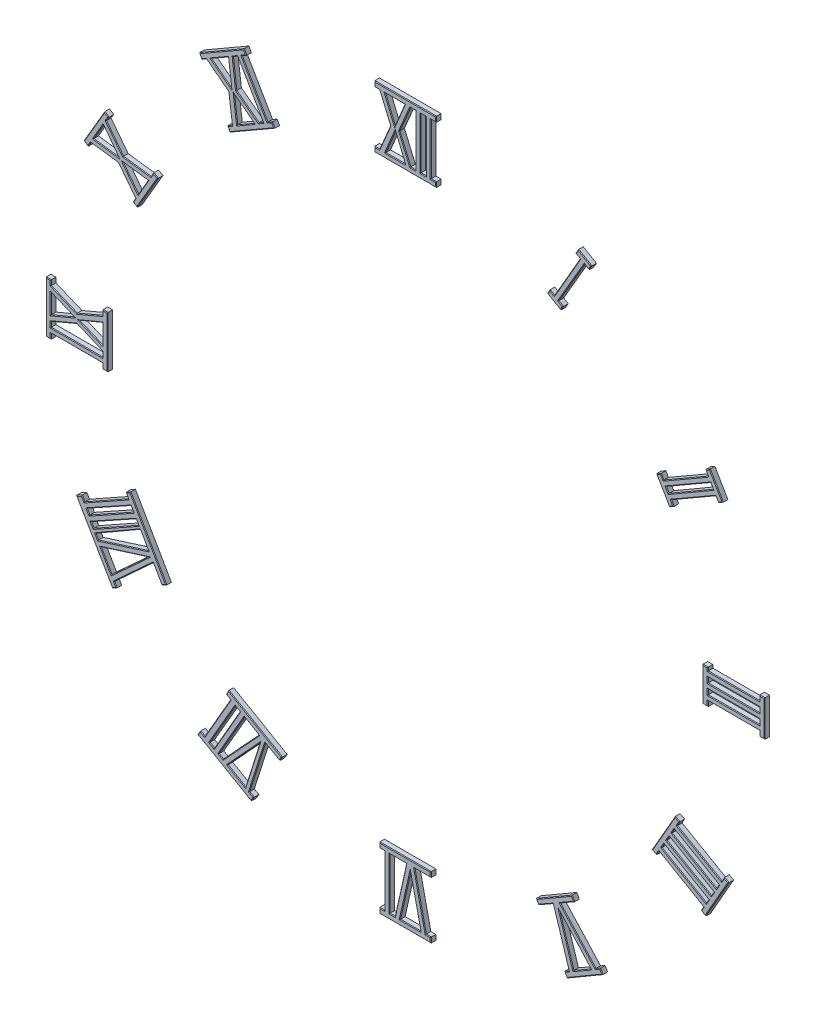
SolidWorks part; units mm, degrees
ref_plane "Спереди" through (0, 0, 0) normal (0, 0, 1) x (1, 0, 0)
ref_plane "Сверху" through (0, 0, 0) normal (0, 1, 0) x (1, 0, 0)
ref_plane "Справа" through (0, 0, 0) normal (1, 0, 0) x (0, 0, -1)
sketch "Эскиз1" plane through (0, 0, 0) normal (0, 0, 1) x (1, 0, 0)
  line L0 (-0.0444, 118.9128) -> (-0.0444, 118.6476)
  line L1 (-3.7575, 127.7538) -> (-0.0444, 118.9128)
  line L2 (-3.7575, 127.7538) -> (-7.5591, 118.6476)
  line L3 (-7.5591, 118.6476) -> (-0.0444, 118.6476)
  line L4 (-3.9345, 129.5221) -> (-7.736, 138.6283)
  line L5 (-3.9345, 129.5221) -> (-0.1327, 138.6283)
  line L6 (-7.736, 138.6283) -> (-0.1327, 138.6283)
  line L7 (-2.1661, 128.6381) -> (2.0775, 138.6283)
  line L8 (-2.1661, 128.6381) -> (2.0775, 118.6476)
  line L9 (2.0775, 118.6476) -> (4.1111, 118.6476)
  line L10 (4.1111, 138.6283) -> (4.1111, 118.6476)
  line L11 (2.0775, 138.6283) -> (4.1111, 138.6283)
  line L12 (6.056, 138.6283) -> (6.056, 118.6476)
  line L13 (6.056, 118.6476) -> (8.0896, 118.6476)
  line L14 (8.0896, 138.6283) -> (8.0896, 118.6476)
  line L15 (6.056, 138.6283) -> (8.0896, 138.6283)
  line L16 (-11.8915, 140.6619) -> (12.0681, 140.6619)
  line L17 (12.0681, 140.6619) -> (12.0681, 138.6283)
  line L18 (10.0345, 138.6283) -> (12.0681, 138.6283)
  line L19 (10.0345, 138.6283) -> (10.0345, 118.6476)
  line L20 (10.0345, 118.6476) -> (12.0681, 118.6476)
  line L21 (12.0681, 116.7026) -> (12.0681, 118.6476)
  line L22 (-11.8915, 116.7026) -> (12.0681, 116.7026)
  line L23 (-11.8915, 116.7026) -> (-11.8915, 118.6476)
  line L24 (-11.8915, 118.6476) -> (-9.9462, 118.6476)
  line L25 (-9.9462, 118.6476) -> (-5.7026, 128.6381)
  line L26 (-9.9462, 138.6283) -> (-5.7026, 128.6381)
  line L27 (-11.8915, 138.6283) -> (-9.9462, 138.6283)
  line L28 (-11.8915, 140.6619) -> (-11.8915, 138.6283)
  line L29 (69.712, 119.7968) -> (71.3917, 118.7358)
  line L30 (69.712, 119.7968) -> (59.633, 102.4683)
  line L31 (59.633, 102.4683) -> (61.4015, 101.4074)
  line L32 (60.4287, 99.7276) -> (61.4015, 101.4074)
  line L33 (55.2126, 102.7336) -> (60.4287, 99.7276)
  line L34 (55.2126, 102.7336) -> (56.1851, 104.4133)
  line L35 (56.1851, 104.4133) -> (57.9534, 103.4408)
  line L36 (67.9438, 120.7694) -> (57.9534, 103.4408)
  line L37 (66.1757, 121.7419) -> (67.9438, 120.7694)
  line L38 (67.2366, 123.51) -> (66.1757, 121.7419)
  line L39 (67.2366, 123.51) -> (72.3642, 120.5042)
  line L40 (72.3642, 120.5042) -> (71.3917, 118.7358)
  line L41 (118.6032, 70.8172) -> (119.5759, 69.0491)
  line L42 (118.6032, 70.8172) -> (101.2748, 60.8267)
  line L43 (101.2748, 60.8267) -> (102.3357, 59.0584)
  line L44 (119.5759, 69.0491) -> (102.3357, 59.0584)
  line L45 (118.3379, 75.2377) -> (123.3774, 66.5735)
  line L46 (123.3774, 66.5735) -> (121.6094, 65.6009)
  line L47 (120.6367, 67.3692) -> (121.6094, 65.6009)
  line L48 (120.6367, 67.3692) -> (103.3083, 57.3787)
  line L49 (103.3083, 57.3787) -> (104.2806, 55.6104)
  line L50 (102.6008, 54.638) -> (104.2806, 55.6104)
  line L51 (97.5615, 63.3022) -> (102.6008, 54.638)
  line L52 (97.5615, 63.3022) -> (99.3298, 64.2749)
  line L53 (99.3298, 64.2749) -> (100.3021, 62.5065)
  line L54 (117.6309, 72.497) -> (100.3021, 62.5065)
  line L55 (116.6582, 74.2652) -> (117.6309, 72.497)
  line L56 (118.3379, 75.2377) -> (116.6582, 74.2652)
  line L57 (117.5422, 4.9508) -> (117.5422, 2.9175)
  line L58 (117.5422, 2.9175) -> (137.5233, 2.9175)
  line L59 (137.5233, 4.9508) -> (137.5233, 2.9175)
  line L60 (117.5422, 4.9508) -> (137.5233, 4.9508)
  line L61 (117.5422, 0.9723) -> (117.5422, -1.0612)
  line L62 (117.5422, -1.0612) -> (137.5233, -1.0612)
  line L63 (137.5233, 0.9723) -> (137.5233, -1.0612)
  line L64 (117.5422, 0.9723) -> (137.5233, 0.9723)
  line L65 (137.5233, -3.0062) -> (137.5233, -5.0395)
  line L66 (117.5422, -3.0062) -> (137.5233, -3.0062)
  line L67 (117.5422, -3.0062) -> (117.5422, -5.0395)
  line L68 (117.5422, -5.0395) -> (115.5089, -5.0395)
  line L69 (115.5089, 8.2222) -> (115.5089, -5.0395)
  line L70 (117.5422, 8.2222) -> (115.5089, 8.2222)
  line L71 (117.5422, 8.2222) -> (117.5422, 6.9845)
  line L72 (117.5422, 6.9845) -> (137.5233, 6.9845)
  line L73 (137.5233, 8.9293) -> (137.5233, 6.9845)
  line L74 (137.5233, 8.9293) -> (139.5566, 8.9293)
  line L75 (139.5566, 8.9293) -> (139.5566, -5.0395)
  line L76 (137.5233, -5.0395) -> (139.5566, -5.0395)
  line L77 (-120.9022, 66.662) -> (-117.1005, 73.2043)
  line L78 (-111.0886, 65.3357) -> (-120.9022, 66.662)
  line L79 (-111.0886, 65.3357) -> (-117.1005, 73.2043)
  line L80 (-105.6071, 53.0466) -> (-104.6345, 54.8147)
  line L81 (-104.6345, 54.8147) -> (-111.2653, 63.3907)
  line L82 (-121.9631, 64.8052) -> (-111.2653, 63.3907)
  line L83 (-123.0241, 63.0369) -> (-121.9631, 64.8052)
  line L84 (-124.7039, 64.0979) -> (-123.0241, 63.0369)
  line L85 (-124.7039, 64.0979) -> (-116.6585, 77.89)
  line L86 (-116.6585, 77.89) -> (-114.9786, 76.8291)
  line L87 (-116.0395, 75.1493) -> (-114.9786, 76.8291)
  line L88 (-109.4087, 66.485) -> (-116.0395, 75.1493)
  line L89 (-109.4087, 66.485) -> (-98.6226, 65.0706)
  line L90 (-98.6226, 65.0706) -> (-97.6501, 66.8387)
  line L91 (-97.6501, 66.8387) -> (-95.8818, 65.8663)
  line L92 (-103.9273, 52.074) -> (-95.8818, 65.8663)
  line L93 (-103.9273, 52.074) -> (-105.6071, 53.0466)
  line L94 (-103.5736, 56.6713) -> (-99.772, 63.2138)
  line L95 (-109.5856, 64.54) -> (-99.772, 63.2138)
  line L96 (-109.5856, 64.54) -> (-103.5736, 56.6713)
  line L97 (104.5458, -52.693) -> (121.8745, -62.6836)
  line L98 (104.5458, -52.693) -> (103.5734, -54.4613)
  line L99 (103.5734, -54.4613) -> (120.9019, -64.4516)
  line L100 (121.8745, -62.6836) -> (120.9019, -64.4516)
  line L101 (102.6008, -56.141) -> (119.9296, -66.1316)
  line L102 (102.6008, -56.141) -> (101.54, -57.9094)
  line L103 (101.54, -57.9094) -> (118.8684, -67.8997)
  line L104 (119.9296, -66.1316) -> (118.8684, -67.8997)
  line L105 (100.5673, -59.6774) -> (117.896, -69.6679)
  line L106 (100.5673, -59.6774) -> (99.5949, -61.3574)
  line L107 (99.5949, -61.3574) -> (116.9234, -71.3478)
  line L108 (117.896, -69.6679) -> (116.9234, -71.3478)
  line L109 (125.5879, -60.208) -> (116.6582, -75.8567)
  line L110 (114.8899, -74.7957) -> (116.6582, -75.8567)
  line L111 (115.8625, -73.116) -> (114.8899, -74.7957)
  line L112 (98.6223, -63.1255) -> (115.8625, -73.116)
  line L113 (98.6223, -63.1255) -> (97.5615, -64.8054)
  line L114 (97.5615, -64.8054) -> (95.8817, -63.8328)
  line L115 (104.811, -48.2725) -> (95.8817, -63.8328)
  line L116 (104.811, -48.2725) -> (106.5793, -49.245)
  line L117 (106.5793, -49.245) -> (105.6067, -51.0133)
  line L118 (105.6067, -51.0133) -> (122.9355, -61.0037)
  line L119 (123.9078, -59.2355) -> (122.9355, -61.0037)
  line L120 (125.5879, -60.208) -> (123.9078, -59.2355)
  line L121 (65.38, -119.797) -> (59.8984, -102.3801)
  line L122 (72.1874, -115.9069) -> (65.38, -119.797)
  line L123 (72.1874, -115.9069) -> (59.8984, -102.3801)
  line L124 (63.6115, -120.858) -> (61.8433, -121.8306)
  line L125 (63.6115, -120.858) -> (57.423, -101.3191)
  line L126 (57.423, -101.3191) -> (51.8531, -104.5019)
  line L127 (50.8804, -102.822) -> (51.8531, -104.5019)
  line L128 (64.761, -94.7768) -> (50.8804, -102.822)
  line L129 (64.761, -94.7768) -> (65.7335, -96.5449)
  line L130 (65.7335, -96.5449) -> (60.1636, -99.7277)
  line L131 (73.9556, -114.846) -> (60.1636, -99.7277)
  line L132 (75.724, -113.8736) -> (73.9556, -114.846)
  line L133 (75.724, -113.8736) -> (76.6965, -115.5532)
  line L134 (76.6965, -115.5532) -> (62.9043, -123.5987)
  line L135 (61.8433, -121.8306) -> (62.9043, -123.5987)
  line L136 (-7.913, -116.2607) -> (-9.9462, -116.2607)
  line L137 (-9.9462, -114.2271) -> (-9.9462, -116.2607)
  line L138 (10.0345, -114.2271) -> (-9.9462, -114.2271)
  line L139 (10.0345, -114.2271) -> (10.0345, -116.2607)
  line L140 (10.0345, -116.2607) -> (3.6689, -116.2607)
  line L141 (8.0896, -136.2414) -> (3.6689, -116.2607)
  line L142 (10.0345, -136.2414) -> (8.0896, -136.2414)
  line L143 (10.0345, -136.2414) -> (10.0345, -138.275)
  line L144 (-1.901, -136.2414) -> (2.0775, -118.4709)
  line L145 (6.056, -136.2414) -> (2.0775, -118.4709)
  line L146 (6.056, -136.2414) -> (-1.901, -136.2414)
  line L147 (-3.9345, -136.2414) -> (-5.9677, -136.2414)
  line L148 (-5.9677, -116.2607) -> (-5.9677, -136.2414)
  line L149 (0.4861, -116.2607) -> (-5.9677, -116.2607)
  line L150 (-3.9345, -136.2414) -> (0.4861, -116.2607)
  line L151 (10.0345, -138.275) -> (-9.9462, -138.275)
  line L152 (-9.9462, -136.2414) -> (-9.9462, -138.275)
  line L153 (-7.913, -136.2414) -> (-9.9462, -136.2414)
  line L154 (-7.913, -116.2607) -> (-7.913, -136.2414)
  line L155 (-70.5963, -116.7026) -> (-72.2761, -115.7301)
  line L156 (-70.5963, -116.7026) -> (-56.7158, -101.6728)
  line L157 (-56.7158, -101.6728) -> (-62.2857, -98.4016)
  line L158 (-62.2857, -98.4016) -> (-72.2761, -115.7301)
  line L159 (-61.932, -121.742) -> (-56.4505, -104.3252)
  line L160 (-68.828, -117.7635) -> (-56.4505, -104.3252)
  line L161 (-61.932, -121.742) -> (-68.828, -117.7635)
  line L162 (-64.0538, -97.429) -> (-65.8221, -96.4564)
  line L163 (-65.8221, -96.4564) -> (-75.8126, -113.6967)
  line L164 (-74.0445, -114.7575) -> (-75.8126, -113.6967)
  line L165 (-64.0538, -97.429) -> (-74.0445, -114.7575)
  line L166 (-47.6978, -104.5903) -> (-48.6703, -106.2701)
  line L167 (-48.6703, -106.2701) -> (-54.2402, -103.0873)
  line L168 (-60.429, -122.6263) -> (-54.2402, -103.0873)
  line L169 (-58.6608, -123.5987) -> (-60.429, -122.6263)
  line L170 (-59.7219, -125.3669) -> (-80.4983, -113.343)
  line L171 (-79.4374, -111.6632) -> (-80.4983, -113.343)
  line L172 (-77.7576, -112.6357) -> (-79.4374, -111.6632)
  line L173 (-67.7671, -95.3072) -> (-77.7576, -112.6357)
  line L174 (-67.7671, -95.3072) -> (-69.447, -94.3346)
  line L175 (-68.4746, -92.5664) -> (-69.447, -94.3346)
  line L176 (-47.6978, -104.5903) -> (-68.4746, -92.5664)
  line L177 (-58.6608, -123.5987) -> (-59.7219, -125.3669)
  line L178 (-99.5951, -61.1805) -> (-102.7779, -55.6106)
  line L179 (-102.7779, -55.6106) -> (-120.1065, -65.6011)
  line L180 (-119.134, -67.3693) -> (-120.1065, -65.6011)
  line L181 (-119.134, -67.3693) -> (-99.5951, -61.1805)
  line L182 (-94.3789, -70.1984) -> (-97.7384, -64.275)
  line L183 (-112.8567, -78.1553) -> (-97.7384, -64.275)
  line L184 (-111.8843, -79.8352) -> (-112.8567, -78.1553)
  line L185 (-125.4112, -55.4338) -> (-127.6215, -56.5832)
  line L186 (-92.6107, -69.2258) -> (-106.5796, -44.9129)
  line L187 (-92.6107, -69.2258) -> (-94.3789, -70.1984)
  line L188 (-122.4936, -60.65) -> (-123.4661, -58.8817)
  line L189 (-105.3419, -51.1016) -> (-122.4936, -60.65)
  line L190 (-105.3419, -51.1016) -> (-106.4028, -49.4219)
  line L191 (-118.0731, -69.1375) -> (-99.5951, -63.3023)
  line L192 (-113.9177, -76.3871) -> (-118.0731, -69.1375)
  line L193 (-113.9177, -76.3871) -> (-99.5951, -63.3023)
  line L194 (-104.3693, -52.8699) -> (-121.8747, -62.5951)
  line L195 (-120.8137, -64.275) -> (-121.8747, -62.5951)
  line L196 (-103.3968, -54.5496) -> (-120.8137, -64.275)
  line L197 (-103.3968, -54.5496) -> (-104.3693, -52.8699)
  line L198 (-106.4028, -49.4219) -> (-123.4661, -58.8817)
  line L199 (-111.8843, -79.8352) -> (-113.5641, -80.8077)
  line L200 (-113.5641, -80.8077) -> (-127.6215, -56.5832)
  line L201 (-124.4387, -57.202) -> (-125.4112, -55.4338)
  line L202 (-107.3753, -47.6536) -> (-124.4387, -57.202)
  line L203 (-107.3753, -47.6536) -> (-108.3478, -45.8854)
  line L204 (-106.5796, -44.9129) -> (-108.3478, -45.8854)
  line L205 (-137.4351, 6.8076) -> (-137.4351, -0.7957)
  line L206 (-128.3287, 3.006) -> (-137.4351, -0.7957)
  line L207 (-137.4351, -3.0062) -> (-137.4351, -5.0395)
  line L208 (-137.4351, -5.0395) -> (-117.3657, -5.0395)
  line L209 (-117.3657, -3.0062) -> (-117.3657, -5.0395)
  line L210 (-127.3562, 1.2377) -> (-117.3657, -3.0062)
  line L211 (-127.3562, 1.2377) -> (-137.4351, -3.0062)
  line L212 (-139.3801, 10.963) -> (-137.4351, 10.963)
  line L213 (-137.4351, 10.963) -> (-137.4351, 9.0179)
  line L214 (-137.4351, 9.0179) -> (-127.3562, 4.7741)
  line L215 (-117.3657, 9.0179) -> (-127.3562, 4.7741)
  line L216 (-117.3657, 10.963) -> (-117.3657, 9.0179)
  line L217 (-115.4207, 10.963) -> (-117.3657, 10.963)
  line L218 (-115.4207, 10.963) -> (-115.4207, -9.018)
  line L219 (-117.3657, -9.018) -> (-115.4207, -9.018)
  line L220 (-139.3801, -9.018) -> (-137.4351, -9.018)
  line L221 (-139.3801, 10.963) -> (-139.3801, -9.018)
  line L222 (-117.3657, 6.6308) -> (-117.3657, -0.9725)
  line L223 (-126.4721, 2.8291) -> (-117.3657, 6.6308)
  line L224 (-126.4721, 2.8291) -> (-117.3657, -0.9725)
  line L225 (-128.3287, 3.006) -> (-137.4351, 6.8076)
  line L226 (-117.3657, -6.9847) -> (-117.3657, -9.018)
  line L227 (-137.4351, -6.9847) -> (-117.3657, -6.9847)
  line L228 (-137.4351, -6.9847) -> (-137.4351, -9.018)
  line L229 (-65.1148, 99.1972) -> (-58.4839, 102.9988)
  line L230 (-66.3526, 109.0107) -> (-58.4839, 102.9988)
  line L231 (-66.3526, 109.0107) -> (-65.1148, 99.1972)
  line L232 (-51.5879, 106.9773) -> (-50.6155, 105.2975)
  line L233 (-67.944, 95.307) -> (-50.6155, 105.2975)
  line L234 (-67.944, 95.307) -> (-68.9165, 96.9868)
  line L235 (-65.0264, 122.3608) -> (-55.0359, 105.0322)
  line L236 (-75.2821, 116.4373) -> (-68.6513, 120.239)
  line L237 (-67.4135, 110.4253) -> (-75.2821, 116.4373)
  line L238 (-67.4135, 110.4253) -> (-68.6513, 120.239)
  line L239 (-53.3563, 106.0046) -> (-51.5879, 106.9773)
  line L240 (-56.8042, 104.0597) -> (-55.0359, 105.0322)
  line L241 (-66.7946, 121.2998) -> (-65.0264, 122.3608)
  line L242 (-68.9165, 96.9868) -> (-67.1483, 98.0477)
  line L243 (-67.1483, 98.0477) -> (-68.5628, 108.7456)
  line L244 (-77.1387, 115.3763) -> (-68.5628, 108.7456)
  line L245 (-78.9069, 114.3155) -> (-77.1387, 115.3763)
  line L246 (-79.8795, 116.0836) -> (-78.9069, 114.3155)
  line L247 (-79.8795, 116.0836) -> (-62.551, 126.074)
  line L248 (-62.551, 126.074) -> (-61.5784, 124.3057)
  line L249 (-63.3467, 123.3333) -> (-61.5784, 124.3057)
  line L250 (-65.4685, 110.6021) -> (-56.8042, 104.0597)
  line L251 (-65.4685, 110.6021) -> (-66.7946, 121.2998)
  line L252 (-63.3467, 123.3333) -> (-53.3563, 106.0046)
  line L253 (138.6787, -143.73) -> (151.3214, -143.73) construction
  line L254 (137.3199, 2.9175) -> (137.3199, 0.9723) construction
  line L255 (-177.5, 1.27) -> (177.5, 1.27) construction
  line L256 (137.3199, 1.9449) -> (141.4091, 1.9449) construction
  line L534 (177.5, 1.27) -> (177.5, -178.73) construction
  line L535 (177.5, -178.73) -> (100, -178.73) construction
  line L536 (100, -178.73) -> (100, -177.73) construction
  line L564 (-98, -175.73) -> (98, -175.73) construction
  line L591 (-100, -178.73) -> (-100, -177.73) construction
  line L1215 (-177.5, 1.27) -> (-177.5, -178.73) construction
  line L1388 (-100, -178.73) -> (-177.5, -178.73) construction
  circle A0 centre (-145, -143.73) radius 6.35 construction
  circle A1 centre (145, -143.73) radius 6.35 construction
  arc A2 (-98, -175.73) -> (-100, -177.73) centre (-98, -177.73) ccw construction
  arc A3 (100, -177.73) -> (98, -175.73) centre (98, -177.73) ccw construction
  circle A4 centre (0, 1.27) radius 6.5 construction
  arc A5 (177.5, 1.27) -> (-177.5, 1.27) centre (0, 1.27) ccw construction
  circle A6 centre (-59.2, 1.27) radius 13 construction
  circle A7 centre (-23.12, -38.7288) radius 3 construction
  circle A8 centre (0, 1.27) radius 46.2 construction
  dimension "D3" = 12.7
  dimension "D9" = 2
  dimension "D10" = 13
  dimension "D11" = 355
  dimension "D13" = 26
  dimension "D15" = 6
  dimension "D17" = 92.4
  dimension "D2" = 177.5
  dimension "D4" = 290
  dimension "D5" = 145
  dimension "D6" = 35
  dimension "D7" = 77.5
  dimension "D8" = 3
  dimension "D12" = 1.27
  dimension "D14" = 59.2
  dimension "D16" = 23.12
  dimension "D19" = 180
extrude "Бобышка-Вытянуть1" add sketch "Эскиз1" along normal blind 2
chamfer "Фаска1" distance 0.25 angle 45 29 edges at (7.0728, 118.6476, 2) (8.0896, 128.6379, 2) (7.0728, 138.6283, 2) (6.056, 128.6379, 2) (-5.8353, 134.0752, 2) (-2.0336, 134.0752, 2) (-3.9344, 138.6283, 2) (0.0883, 140.6619, 2) (12.0681, 139.6451, 2) (11.0513, 138.6283, 2) (10.0345, 128.6379, 2) (11.0513, 118.6476, 2) (12.0681, 117.6751, 2) (0.0883, 116.7026, 2) (-11.8915, 117.6751, 2) (-10.9189, 118.6476, 2) (-7.8244, 123.6428, 2) (-7.8244, 133.6332, 2) (-10.9189, 138.6283, 2) (-11.8915, 139.6451, 2) (-3.8018, 118.6476, 2) (-0.0444, 118.7802, 2) (-1.9009, 123.3333, 2) (-5.6583, 123.2007, 2) (4.1111, 128.6379, 2) (3.0943, 138.6283, 2) (-0.0443, 133.6332, 2) (-0.0443, 123.6428, 2) (3.0943, 118.6476, 2)
chamfer "Фаска2" distance 0.25 angle 45 12 edges at (60.5173, 101.9378, 2) (60.9151, 100.5675, 2) (57.8207, 101.2306, 2) (55.6989, 103.5735, 2) (57.0693, 103.9271, 2) (62.9486, 112.1051, 2) (67.0598, 121.2557, 2) (66.7061, 122.626, 2) (69.8004, 122.0071, 2) (71.8779, 119.62, 2) (70.5519, 119.2663, 2) (64.6725, 111.1325, 2)
chamfer "Фаска3" distance 0.25 angle 45 16 edges at (110.9558, 64.0537, 2) (119.0896, 69.9331, 2) (109.939, 65.822, 2) (101.8053, 59.9425, 2) (120.8577, 70.9056, 2) (122.4934, 66.0872, 2) (121.1231, 66.4851, 2) (111.9725, 62.374, 2) (103.7945, 56.4946, 2) (103.4407, 55.1242, 2) (100.0812, 58.9701, 2) (98.4457, 63.7886, 2) (99.816, 63.3907, 2) (108.9665, 67.5018, 2) (117.1445, 73.3811, 2) (117.498, 74.7514, 2)
chamfer "Фаска4" distance 0.25 angle 45 20 edges at (117.5422, -0.0445, 2) (127.5328, -1.0612, 2) (137.5233, -0.0444, 2) (127.5328, 0.9723, 2) (117.5422, -4.0229, 2) (116.5256, -5.0395, 2) (115.5089, 1.5914, 2) (116.5256, 8.2222, 2) (117.5422, 7.6033, 2) (127.5328, 6.9845, 2) (137.5233, 7.9569, 2) (138.54, 8.9293, 2) (139.5566, 1.9449, 2) (138.54, -5.0395, 2) (137.5233, -4.0229, 2) (127.5328, -3.0062, 2) (117.5422, 3.9341, 2) (127.5328, 2.9175, 2) (137.5233, 3.9341, 2) (127.5328, 4.9508, 2)
chamfer "Фаска5" distance 0.25 angle 45 24 edges at (117.4097, -70.5079, 2) (109.2317, -64.6727, 2) (100.0811, -60.5174, 2) (108.2592, -66.3526, 2) (121.3882, -63.5676, 2) (113.2102, -57.6883, 2) (104.0596, -53.5772, 2) (112.2377, -59.4565, 2) (121.123, -68.0323, 2) (115.774, -75.3262, 2) (115.3762, -73.9558, 2) (107.2424, -68.1208, 2) (98.0919, -63.9655, 2) (96.7216, -64.3191, 2) (100.3464, -56.0526, 2) (105.6952, -48.7588, 2) (106.093, -50.1291, 2) (114.2711, -56.0085, 2) (123.4216, -60.1196, 2) (124.7478, -59.7218, 2) (119.399, -67.0157, 2) (111.2652, -61.1363, 2) (102.0704, -57.0252, 2) (110.2042, -62.9046, 2)
chamfer "Фаска6" distance 0.25 angle 45 15 edges at (62.6392, -111.0886, 2) (68.7837, -117.852, 2) (66.0429, -109.1435, 2) (54.638, -102.9105, 2) (51.3668, -103.662, 2) (57.8207, -98.7994, 2) (65.2473, -95.6608, 2) (62.9486, -98.1363, 2) (67.0596, -107.2869, 2) (74.8398, -114.3598, 2) (76.2103, -114.7134, 2) (69.8004, -119.576, 2) (62.3738, -122.7147, 2) (62.7274, -121.3443, 2) (60.5173, -111.0886, 2)
chamfer "Фаска7" distance 0.25 angle 45 19 edges at (-2.7408, -116.2607, 2) (-5.9677, -126.2511, 2) (-4.9511, -136.2414, 2) (-1.7242, -126.2511, 2) (-8.9296, -116.2607, 2) (-9.9462, -115.2439, 2) (0.0442, -114.2271, 2) (10.0345, -115.2439, 2) (6.8517, -116.2607, 2) (5.8793, -126.2511, 2) (9.0621, -136.2414, 2) (10.0345, -137.2582, 2) (0.0442, -138.275, 2) (-9.9462, -137.2582, 2) (-8.9296, -136.2414, 2) (-7.913, -126.2511, 2) (4.0668, -127.3561, 2) (0.0883, -127.3561, 2) (2.0775, -136.2414, 2)
chamfer "Фаска8" distance 0.25 angle 45 23 edges at (-70.8174, -105.0766, 2) (-74.9286, -114.2271, 2) (-69.0491, -106.0932, 2) (-64.938, -96.9427, 2) (-67.2809, -107.0658, 2) (-71.4362, -116.2163, 2) (-63.6561, -109.1877, 2) (-59.5008, -100.0372, 2) (-48.184, -105.4302, 2) (-51.4552, -104.6787, 2) (-57.3346, -112.8568, 2) (-59.5449, -123.1125, 2) (-59.1914, -124.4828, 2) (-70.1101, -119.355, 2) (-79.9679, -112.5031, 2) (-78.5975, -112.1495, 2) (-72.7623, -103.9714, 2) (-68.6071, -94.8209, 2) (-68.9608, -93.4505, 2) (-58.0862, -98.5784, 2) (-62.6392, -111.0443, 2) (-65.38, -119.7527, 2) (-59.1913, -113.0336, 2)
chamfer "Фаска9" distance 0.25 angle 45 27 edges at (-113.122, -57.7325, 2) (-121.3442, -63.4351, 2) (-112.1052, -59.4123, 2) (-103.8831, -53.7097, 2) (-105.8723, -50.2617, 2) (-114.9344, -54.1518, 2) (-122.9798, -59.7658, 2) (-113.9178, -55.8758, 2) (-96.0587, -67.2367, 2) (-105.2976, -71.2152, 2) (-112.3705, -78.9952, 2) (-112.7242, -80.3214, 2) (-120.5928, -68.6954, 2) (-126.5164, -56.0085, 2) (-124.925, -56.3179, 2) (-115.907, -52.4278, 2) (-107.8615, -46.7695, 2) (-107.4637, -45.3991, 2) (-99.5951, -57.0694, 2) (-93.4948, -69.7121, 2) (-101.1865, -58.3956, 2) (-111.4422, -60.6059, 2) (-119.6203, -66.4852, 2) (-109.3646, -64.2749, 2) (-106.7564, -69.8447, 2) (-108.8341, -66.2199, 2) (-115.9954, -72.7623, 2)
chamfer "Фаска10" distance 0.25 angle 45 24 edges at (-117.3657, 2.8291, 2) (-121.9189, 4.73, 2) (-121.9189, 0.9283, 2) (-132.8819, 1.1051, 2) (-132.8819, 4.9068, 2) (-137.4351, 3.0059, 2) (-138.4076, 10.963, 2) (-137.4351, 9.9904, 2) (-132.3957, 6.896, 2) (-122.361, 6.896, 2) (-117.3657, 9.9904, 2) (-116.3932, 10.963, 2) (-115.4207, 0.9725, 2) (-116.3932, -9.018, 2) (-117.3657, -8.0014, 2) (-127.4004, -6.9847, 2) (-137.4351, -8.0014, 2) (-138.4076, -9.018, 2) (-139.3801, 0.9725, 2) (-127.4004, -5.0395, 2) (-117.3657, -4.0229, 2) (-122.361, -0.8843, 2) (-132.3957, -0.8843, 2) (-137.4351, -4.0229, 2)
chamfer "Фаска11" distance 0.25 angle 45 20 edges at (-101.6728, 59.9425, 2) (-104.6788, 63.8769, 2) (-106.5796, 60.6057, 2) (-105.1208, 53.9306, 2) (-107.9499, 59.1027, 2) (-116.6142, 64.098, 2) (-122.4936, 63.9211, 2) (-123.864, 63.5674, 2) (-120.6812, 70.9939, 2) (-115.8186, 77.3595, 2) (-115.5091, 75.9892, 2) (-112.7241, 70.8171, 2) (-104.0157, 65.7778, 2) (-98.1364, 65.9547, 2) (-96.766, 66.3525, 2) (-99.9046, 58.9701, 2) (-104.7672, 52.5603, 2) (-114.0945, 69.27, 2) (-119.0014, 69.9331, 2) (-115.9954, 65.9989, 2)
chamfer "Фаска12" distance 0.25 angle 45 24 edges at (-68.0324, 115.3321, 2) (-71.9667, 118.3381, 2) (-71.3478, 113.4313, 2) (-61.7994, 101.098, 2) (-62.4182, 106.0048, 2) (-65.7337, 104.1039, 2) (-51.1017, 106.1374, 2) (-59.2798, 100.3023, 2) (-68.4303, 96.1469, 2) (-68.0324, 97.5173, 2) (-67.8555, 103.3967, 2) (-72.8507, 112.0609, 2) (-78.0228, 114.8459, 2) (-79.3932, 115.1996, 2) (-71.2153, 121.0788, 2) (-62.0647, 125.1898, 2) (-62.4626, 123.8195, 2) (-58.3515, 114.6689, 2) (-52.4721, 106.4909, 2) (-66.1316, 115.9509, 2) (-61.1364, 107.3309, 2) (-55.92, 104.546, 2) (-60.0311, 113.6965, 2) (-65.9105, 121.8303, 2)
